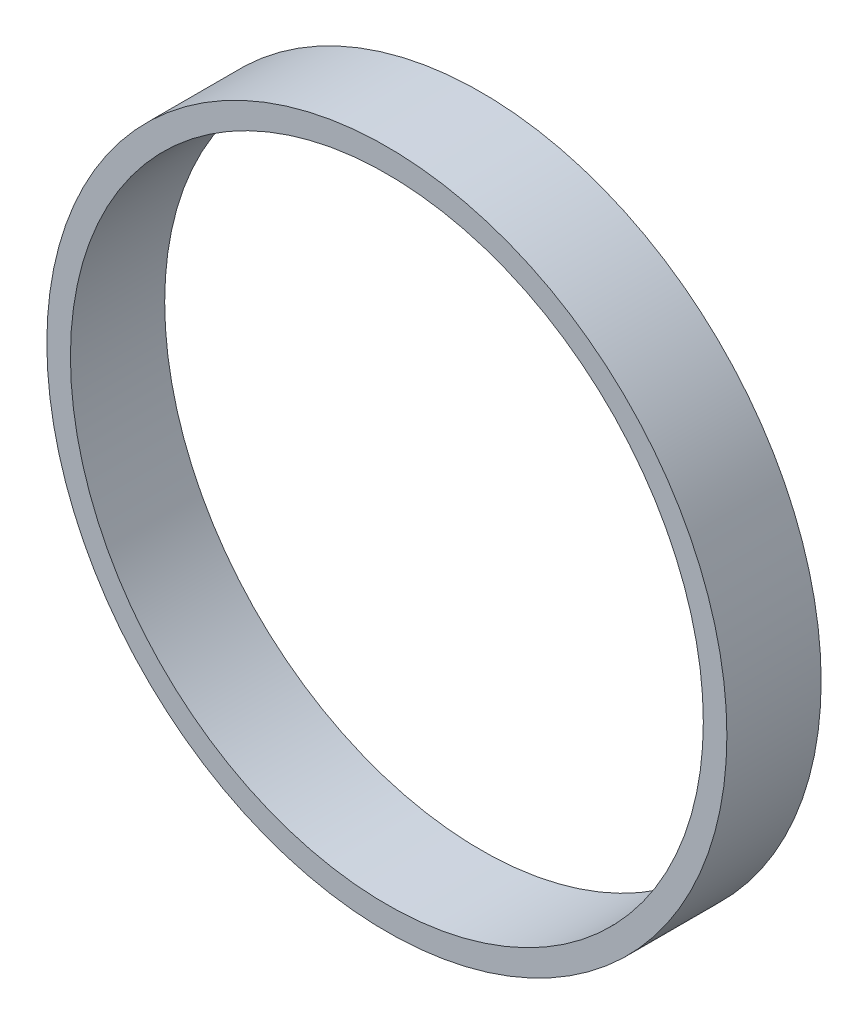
SolidWorks part; units mm, degrees
ref_plane "Front Plane" through (0, 0, 0) normal (0, 0, 1) x (1, 0, 0)
ref_plane "Top Plane" through (0, 0, 0) normal (0, 1, 0) x (1, 0, 0)
ref_plane "Right Plane" through (0, 0, 0) normal (1, 0, 0) x (0, 0, -1)
sketch "Sketch1" plane through (0, 0, 0) normal (0, 0, 1) x (1, 0, 0)
  circle A0 centre (0, 0) radius 25.25
  circle A1 centre (0, 0) radius 23.5
  dimension "D1" = 47
  dimension "D2" = 1.75
extrude "Boss-Extrude1" add sketch "Sketch1" along normal mid plane 7
